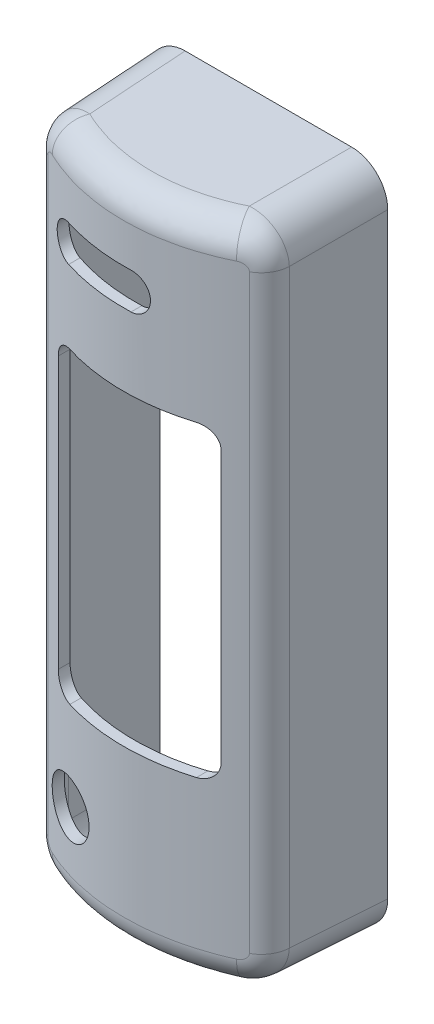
SolidWorks part; units mm, degrees
ref_plane "Front" through (0, 0, 0) normal (0, 0, 1) x (1, 0, 0)
ref_plane "Top" through (0, 0, 0) normal (0, 1, 0) x (1, 0, 0)
ref_plane "Right" through (0, 0, 0) normal (1, 0, 0) x (0, 0, -1)
sketch "Sketch1" plane through (0, 0, 0) normal (0, 1, 0) x (1, 0, 0)
  line L0 (-33, -49.45) -> (-33, -19.45)
  line L1 (-33, -19.45) -> (33, -19.45)
  line L2 (33, -19.45) -> (33, -49.45)
  arc A0 (-33, -49.45) -> (33, -49.45) centre (0, 0) ccw
  dimension "D3" = 10
  dimension "D4" = 59.45
  dimension "D1" = 66
  dimension "D2" = 40
extrude "main" add sketch "Sketch1" along normal blind 185
draft "front draft" draft angle 2 neutral plane "Front" parameters "D1"=2
fillet "R10" radius 10 6 edges at (-32.464, 184.464, 34.7994) (0, 183.6032, 59.45) (-32.464, 0.536, 34.7994) (32.464, 0.536, 34.7994) (0, 1.3968, 59.45) (32.464, 184.464, 34.7994)
fillet "R8" radius 8 8 edges at (31.928, 92.5, 50.1488) (0, 1.3968, 59.45) (0, 183.6032, 59.45) (-31.928, 92.5, 50.1488) (30.2697, 179.3593, 51.1669) (-28.6175, 181.2352, 52.1089) (-30.2697, 5.6407, 51.1669) (28.6175, 3.7648, 52.1089)
shell "Shell1" thickness 3
sketch "opening locations" plane through (0, 0, 0) normal (0, 0, 1) x (1, 0, 0)
  line L0 (-50.0634, 160) -> (48.3225, 160) construction
  line L1 (-50.0634, 50) -> (48.3225, 50) construction
  line L2 (-50.0634, 25) -> (48.3225, 25) construction
  line L3 (23.0061, 185) -> (-23.0061, 185) construction
  dimension "D1" = 25
  dimension "D2" = 135
  dimension "D3" = 160
sketch "Sketch3" plane through (0, 0, 0) normal (0, 0, 1) x (1, 0, 0)
  line L0 (0, 135) -> (0, 50) construction
  line L1 (-17.5, 135) -> (17.5, 135)
  line L2 (-22.5, 130) -> (-22.5, 55)
  line L3 (-17.5, 50) -> (17.5, 50)
  line L4 (22.5, 130) -> (22.5, 55)
  line L5 (-50.0634, 50) -> (48.3225, 50) construction
  arc A0 (22.5, 55) -> (17.5, 50) centre (17.5, 55) cw
  arc A1 (22.5, 130) -> (17.5, 135) centre (17.5, 130) ccw
  arc A2 (-22.5, 130) -> (-17.5, 135) centre (-17.5, 130) cw
  arc A3 (-17.5, 50) -> (-22.5, 55) centre (-17.5, 55) cw
  dimension "D1" = 5
  dimension "D2" = 85
  dimension "D3" = 45
extrude "woofer" cut sketch "Sketch3" along normal through all
sketch "Sketch4" plane through (0, 0, 0) normal (0, 0, 1) x (1, 0, 0)
  line L0 (-18, 165) -> (2, 165)
  line L1 (2, 155) -> (-18, 155)
  line L2 (-50.0634, 160) -> (48.3225, 160) construction
  line L5 (-33, 175.0061) -> (-33, 9.9939) construction
  arc A0 (2, 165) -> (2, 155) centre (2, 160) cw
  arc A1 (-18, 155) -> (-18, 165) centre (-18, 160) cw
  dimension "D2" = 30
  dimension "D1" = 10
  dimension "D3" = 15
extrude "rounded tweeter" cut sketch "Sketch4" along normal through all
sketch "Sketch5" plane through (0, 0, 0) normal (0, 0, 1) x (1, 0, 0)
  line L0 (-50.0634, 25) -> (48.3225, 25) construction
  line L2 (-33, 175.0061) -> (-33, 9.9939) construction
  circle A0 centre (-18, 25) radius 7.5
  dimension "D1" = 15
  dimension "D2" = 15
extrude "volume control" cut sketch "Sketch5" along normal through all
sketch "Sketch6" plane through (0, 0, 19.45) normal (0, 0, -1) x (-1, 0, 0)
  line L0 (50.0634, 160) -> (-48.3225, 160) construction
  line L1 (21, 170) -> (-21, 170)
  line L2 (26, 165) -> (26, 155)
  line L3 (21, 150) -> (-21, 150)
  line L4 (-26, 165) -> (-26, 155)
  line L5 (33, 175.0061) -> (33, 9.9939) construction
  line L6 (-33, 175.0061) -> (-33, 9.9939) construction
  arc A0 (26, 155) -> (21, 150) centre (21, 155) cw
  arc A1 (21, 170) -> (26, 165) centre (21, 165) cw
  arc A2 (-21, 170) -> (-26, 165) centre (-21, 165) ccw
  arc A3 (-21, 150) -> (-26, 155) centre (-21, 155) cw
  dimension "D5" = 5
  dimension "D1" = 10
  dimension "D2" = 20
  dimension "D3" = 7
  dimension "D4" = 7
extrude "tweeter" cut sketch "Sketch6" against normal through all
